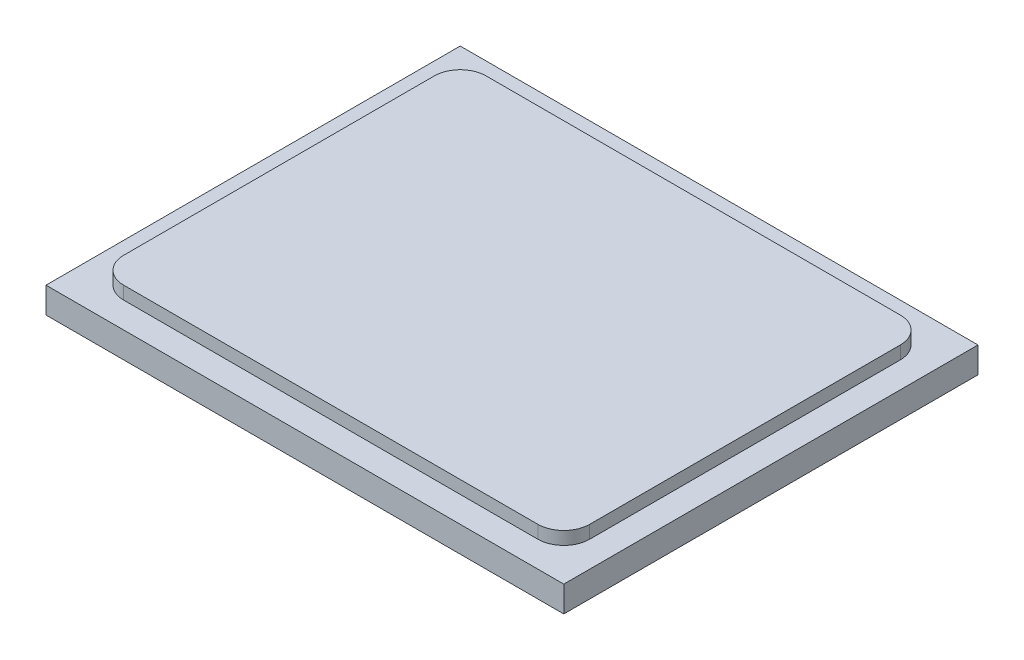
SolidWorks part; units mm, degrees
ref_plane "Front Plane" through (0, 0, 0) normal (0, 0, 1) x (1, 0, 0)
ref_plane "Top Plane" through (0, 0, 0) normal (0, 1, 0) x (1, 0, 0)
ref_plane "Right Plane" through (0, 0, 0) normal (1, 0, 0) x (0, 0, -1)
sketch "Sketch1" plane through (0, 0, 0) normal (0, 1, 0) x (1, 0, 0)
  line L1 (-47.2209, 28.8631) -> (79.7791, 28.8631)
  line L2 (-47.2209, 28.8631) -> (-47.2209, -72.7369)
  line L3 (-47.2209, -72.7369) -> (79.7791, -72.7369)
  line L4 (79.7791, 28.8631) -> (79.7791, -72.7369)
  dimension "D1" = 127
  dimension "D2" = 101.6
extrude "Boss-Extrude1" add sketch "Sketch1" along normal blind 6.35
sketch "Sketch2" plane through (0, 6.35, 0) normal (0, 1, 0) x (1, 0, 0)
  line L0 (-47.2209, 28.8631) -> (-47.2209, -72.7369) construction
  line L1 (-40.8709, 22.5131) -> (73.4291, 22.5131)
  line L2 (-40.8709, 22.5131) -> (-40.8709, -66.3869)
  line L3 (-40.8709, -66.3869) -> (73.4291, -66.3869)
  line L4 (73.4291, 22.5131) -> (73.4291, -66.3869)
  line L5 (79.7791, 28.8631) -> (-47.2209, 28.8631) construction
  dimension "D1" = 114.3
  dimension "D2" = 88.9
  dimension "D3" = 6.35
  dimension "D4" = 6.35
extrude "Boss-Extrude2" add sketch "Sketch2" along normal blind 3.175
sketch "Sketch3" plane through (0, 9.525, 0) normal (0, 1, 0) x (1, 0, 0)
  line L0 (73.4291, 22.5131) -> (-40.8709, 22.5131) construction
  line L1 (-40.8709, 22.5131) -> (-40.8709, -66.3869) construction
  line L2 (73.4291, 16.1631) -> (67.0791, 16.1631)
  line L3 (-40.8709, -66.3869) -> (73.4291, -66.3869) construction
  line L4 (73.4291, -66.3869) -> (73.4291, 22.5131) construction
  line L5 (67.0791, 16.1631) -> (67.0791, 22.5131)
  line L6 (73.4291, 22.5131) -> (-40.8709, 22.5131) construction
  line L7 (-40.8709, 16.1631) -> (-40.8709, 22.5131)
  line L8 (-40.8709, 22.5131) -> (-34.5209, 22.5131)
  line L9 (-34.5209, 22.5131) -> (-40.8709, 16.1631)
  line L10 (67.0791, 22.5131) -> (73.4291, 22.5131)
  line L11 (73.4291, 22.5131) -> (73.4291, 16.1631)
  line L12 (73.4291, 16.1631) -> (67.0791, 22.5131)
  line L13 (73.4291, 16.1631) -> (67.0791, 16.1631)
  line L14 (67.0791, -66.3869) -> (73.4291, -66.3869)
  line L15 (73.4291, -66.3869) -> (73.4291, -60.0369)
  line L16 (73.4291, -60.0369) -> (67.0791, -66.3869)
  line L17 (-40.8709, -60.0369) -> (-40.8709, -66.3869)
  line L18 (-40.8709, -66.3869) -> (-34.5209, -66.3869)
  line L19 (-34.5209, -66.3869) -> (-40.8709, -60.0369)
  circle A0 centre (-34.5209, 16.1631) radius 6.35
  circle A1 centre (67.0791, 16.1631) radius 6.35
  circle A2 centre (-34.5209, -60.0369) radius 6.35
  circle A3 centre (67.0791, -60.0369) radius 6.35
  dimension "D1" = 6.35
  dimension "D3" = 6.35
  dimension "D2" = 6.35
  dimension "D4" = 6.35
  dimension "D5" = 6.35
extrude "Cut-Extrude1" cut sketch "Sketch3" against normal blind 3.175 contours A3 M2 M3 | A1 M3 M4 | A0 M4 M1 | A2 M1 M2
